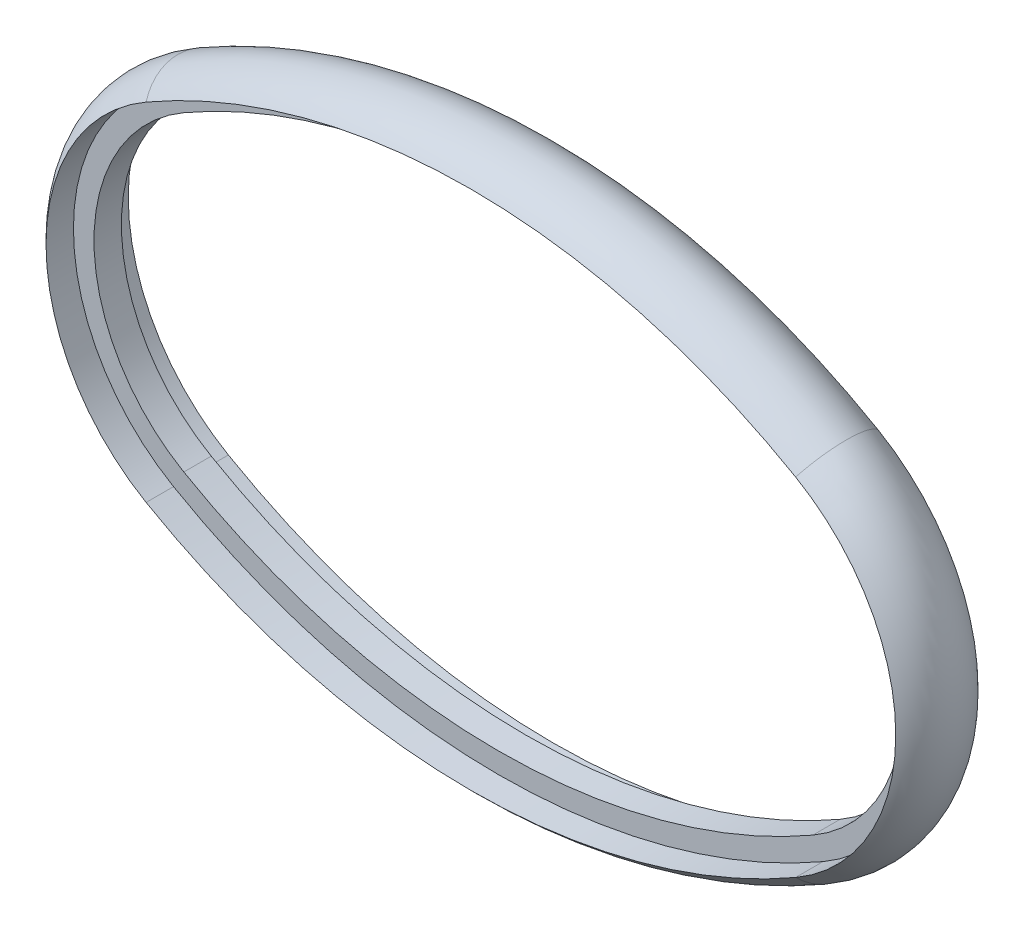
SolidWorks part; units mm, degrees
ref_plane "Plan de face" through (0, 0, 0) normal (0, 0, 1) x (1, 0, 0)
ref_plane "Plan de dessus" through (0, 0, 0) normal (0, 1, 0) x (1, 0, 0)
ref_plane "Plan de droite" through (0, 0, 0) normal (1, 0, 0) x (0, 0, -1)
sketch "Esquisse1" plane through (0, 0, 0) normal (0, 0, 1) x (1, 0, 0)
  line L0 (3.3, 0) -> (-3.3, 0) construction
  line L1 (-31, 0) -> (31, 0) construction
  line L2 (-31, 0) -> (-31, -38) construction
  line L3 (-31, -38) -> (31, -38) construction
  line L4 (31, 0) -> (31, -38) construction
  line L5 (-23.6962, -6.3494) -> (-12.6987, 0) construction
  line L6 (0, -3.3) -> (0, 3.3) construction
  line L7 (-31, -19) -> (31, -19) construction
  line L8 (0, 0) -> (0, -38) construction
  arc A0 (23.6962, -6.3494) -> (-23.6962, -6.3494) centre (0, -47.3923) ccw
  arc A1 (23.6962, -31.6506) -> (-23.6962, -31.6506) centre (0, 9.3923) cw
  arc A2 (-23.6962, -6.3494) -> (-23.6962, -31.6506) centre (-16.3923, -19) ccw
  arc A3 (23.6962, -6.3494) -> (23.6962, -31.6506) centre (16.3923, -19) cw
  point P6 (0, 0)
  point P20 (-31, -19)
  dimension "D1" = 62
  dimension "D2" = 38
  dimension "D3" = 30
sketch "Esquisse2" plane through (0, 0, 0) normal (1, 0, 0) x (0, 0, -1)
  line L0 (-3, 0) -> (-1, 0)
  line L1 (3.3, 0) -> (-3.3, 0) construction
  line L2 (-1, 0) -> (-1, -1.5)
  line L3 (-1, -1.5) -> (1, -1.5)
  line L4 (1, -1.5) -> (1, 0)
  line L5 (1, 0) -> (3, 0)
  line L6 (0, -6.3494) -> (0, 0) construction
  arc A0 (-3, 0) -> (3, 0) centre (0, -2.6458) cw
  point P5 (0, -1.5)
  dimension "D3" = 4
  dimension "D1" = 2
  dimension "D2" = 1.5
  dimension "D4" = 6
sweep "Balayage1" add profiles "Esquisse2" path "Esquisse1"
